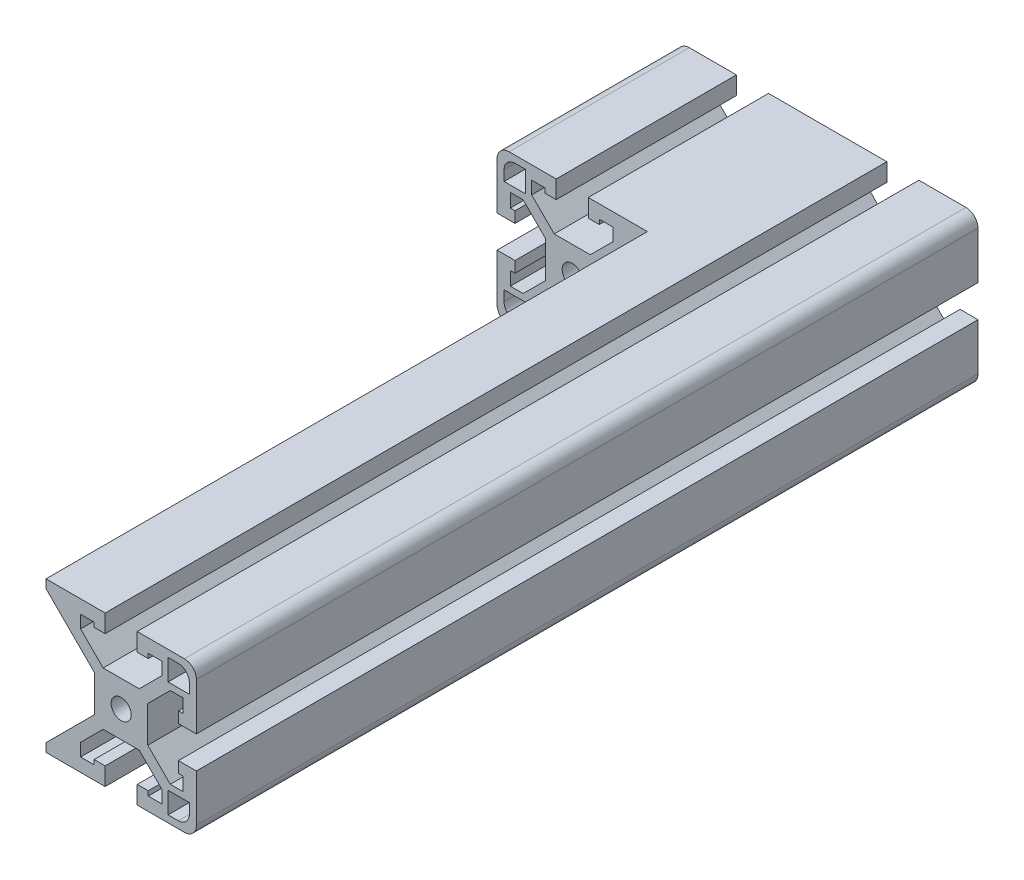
SolidWorks part; units mm, degrees
ref_plane "Front" through (0, 0, 0) normal (0, 0, 1) x (1, 0, 0)
ref_plane "Top" through (0, 0, 0) normal (0, 1, 0) x (1, 0, 0)
ref_plane "Right" through (0, 0, 0) normal (1, 0, 0) x (0, 0, -1)
sketch "Sketch1" plane through (0, 0, 0) normal (0, 0, 1) x (1, 0, 0)
  line L0 (-12.319, 4.5757) -> (-12.319, -4.5757)
  line L1 (0, 16.8947) -> (-12.319, 4.5757)
  line L2 (12.319, 4.5757) -> (0, 16.8947)
  line L3 (12.319, -4.5757) -> (12.319, 4.5757)
  line L4 (0, -16.8947) -> (12.319, -4.5757)
  line L5 (-12.319, -4.5757) -> (0, -16.8947)
  line L6 (-30.9372, 11.8872) -> (-30.9372, 17.272)
  line L7 (-36.322, 11.8872) -> (-30.9372, 11.8872)
  line L8 (-36.322, 14.478) -> (-36.322, 11.8872)
  line L9 (-30.9372, 17.272) -> (-33.528, 17.272)
  line L10 (-30.9372, -17.272) -> (-30.9372, -11.8872)
  line L11 (-33.528, -17.272) -> (-30.9372, -17.272)
  line L12 (-36.322, -11.8872) -> (-36.322, -14.478)
  line L13 (-30.9372, -11.8872) -> (-36.322, -11.8872)
  line L14 (36.322, -11.8872) -> (30.9372, -11.8872)
  line L15 (36.322, -14.478) -> (36.322, -11.8872)
  line L16 (30.9372, -17.272) -> (33.528, -17.272)
  line L17 (30.9372, -11.8872) -> (30.9372, -17.272)
  line L18 (30.9372, 17.272) -> (30.9372, 11.8872)
  line L19 (33.528, 17.272) -> (30.9372, 17.272)
  line L20 (36.322, 11.8872) -> (36.322, 14.478)
  line L21 (30.9372, 11.8872) -> (36.322, 11.8872)
  line L22 (-29.337, 12.4423) -> (-29.337, 15.6718)
  line L23 (-29.337, 15.6718) -> (-25.908, 15.6718)
  line L24 (-25.908, 15.6718) -> (-25.908, 14.5034)
  line L25 (-25.908, 14.5034) -> (-23.114, 14.5034)
  line L26 (-23.114, 14.5034) -> (-23.114, 19.05)
  line L27 (-23.114, 19.05) -> (-35.052, 19.05)
  line L28 (-38.1, 16.002) -> (-38.1, 4.064)
  line L29 (-38.1, 4.064) -> (-33.5534, 4.064)
  line L30 (-33.5534, 4.064) -> (-33.5534, 6.858)
  line L31 (-33.5534, 6.858) -> (-34.7218, 6.858)
  line L32 (-34.7218, 6.858) -> (-34.7218, 10.287)
  line L33 (-34.7218, 10.287) -> (-31.4923, 10.287)
  line L34 (-31.4923, 10.287) -> (-25.781, 4.5757)
  line L35 (-25.781, 4.5757) -> (-25.781, -4.5757)
  line L36 (-25.781, -4.5757) -> (-31.4923, -10.287)
  line L37 (-31.4923, -10.287) -> (-34.7218, -10.287)
  line L38 (-34.7218, -10.287) -> (-34.7218, -6.858)
  line L39 (-34.7218, -6.858) -> (-33.5534, -6.858)
  line L40 (-33.5534, -6.858) -> (-33.5534, -4.064)
  line L41 (-33.5534, -4.064) -> (-38.1, -4.064)
  line L42 (-38.1, -4.064) -> (-38.1, -16.002)
  line L43 (-35.052, -19.05) -> (-23.114, -19.05)
  line L44 (-23.114, -19.05) -> (-23.114, -14.5034)
  line L45 (-23.114, -14.5034) -> (-25.908, -14.5034)
  line L46 (-25.908, -14.5034) -> (-25.908, -15.6718)
  line L47 (-25.908, -15.6718) -> (-29.337, -15.6718)
  line L48 (-29.337, -15.6718) -> (-29.337, -12.4423)
  line L49 (-29.337, -12.4423) -> (-23.6257, -6.731)
  line L50 (-23.6257, -6.731) -> (-14.4743, -6.731)
  line L51 (-14.4743, -6.731) -> (-8.763, -12.4423)
  line L52 (-8.763, -12.4423) -> (-8.763, -15.6718)
  line L53 (-8.763, -15.6718) -> (-12.192, -15.6718)
  line L54 (-12.192, -15.6718) -> (-12.192, -14.5034)
  line L55 (-12.192, -14.5034) -> (-14.986, -14.5034)
  line L56 (-14.986, -14.5034) -> (-14.986, -19.05)
  line L57 (-14.986, -19.05) -> (14.986, -19.05)
  line L58 (14.986, -19.05) -> (14.986, -14.5034)
  line L59 (14.986, -14.5034) -> (12.192, -14.5034)
  line L60 (12.192, -14.5034) -> (12.192, -15.6718)
  line L61 (12.192, -15.6718) -> (8.763, -15.6718)
  line L62 (8.763, -15.6718) -> (8.763, -12.4423)
  line L63 (8.763, -12.4423) -> (14.4743, -6.731)
  line L64 (14.4743, -6.731) -> (23.6257, -6.731)
  line L65 (23.6257, -6.731) -> (29.337, -12.4423)
  line L66 (29.337, -12.4423) -> (29.337, -15.6718)
  line L67 (29.337, -15.6718) -> (25.908, -15.6718)
  line L68 (25.908, -15.6718) -> (25.908, -14.5034)
  line L69 (25.908, -14.5034) -> (23.114, -14.5034)
  line L70 (23.114, -14.5034) -> (23.114, -19.05)
  line L71 (23.114, -19.05) -> (35.052, -19.05)
  line L72 (38.1, -16.002) -> (38.1, -4.064)
  line L73 (38.1, -4.064) -> (33.5534, -4.064)
  line L74 (33.5534, -4.064) -> (33.5534, -6.858)
  line L75 (33.5534, -6.858) -> (34.7218, -6.858)
  line L76 (34.7218, -6.858) -> (34.7218, -10.287)
  line L77 (34.7218, -10.287) -> (31.4923, -10.287)
  line L78 (31.4923, -10.287) -> (25.781, -4.5757)
  line L79 (25.781, -4.5757) -> (25.781, 4.5757)
  line L80 (25.781, 4.5757) -> (31.4923, 10.287)
  line L81 (31.4923, 10.287) -> (34.7218, 10.287)
  line L82 (34.7218, 10.287) -> (34.7218, 6.858)
  line L83 (34.7218, 6.858) -> (33.5534, 6.858)
  line L84 (33.5534, 6.858) -> (33.5534, 4.064)
  line L85 (33.5534, 4.064) -> (38.1, 4.064)
  line L86 (38.1, 4.064) -> (38.1, 16.002)
  line L87 (35.052, 19.05) -> (23.114, 19.05)
  line L88 (23.114, 19.05) -> (23.114, 14.5034)
  line L89 (23.114, 14.5034) -> (25.908, 14.5034)
  line L90 (25.908, 14.5034) -> (25.908, 15.6718)
  line L91 (25.908, 15.6718) -> (29.337, 15.6718)
  line L92 (29.337, 15.6718) -> (29.337, 12.4423)
  line L93 (29.337, 12.4423) -> (23.6257, 6.731)
  line L94 (23.6257, 6.731) -> (14.4743, 6.731)
  line L95 (14.4743, 6.731) -> (8.763, 12.4423)
  line L96 (8.763, 12.4423) -> (8.763, 15.6718)
  line L97 (8.763, 15.6718) -> (12.192, 15.6718)
  line L98 (12.192, 15.6718) -> (12.192, 14.5034)
  line L99 (12.192, 14.5034) -> (14.986, 14.5034)
  line L100 (14.986, 14.5034) -> (14.986, 19.05)
  line L101 (14.986, 19.05) -> (-14.986, 19.05)
  line L102 (-14.986, 19.05) -> (-14.986, 14.5034)
  line L103 (-14.986, 14.5034) -> (-12.192, 14.5034)
  line L104 (-12.192, 14.5034) -> (-12.192, 15.6718)
  line L105 (-12.192, 15.6718) -> (-8.763, 15.6718)
  line L106 (-8.763, 15.6718) -> (-8.763, 12.4423)
  line L107 (-8.763, 12.4423) -> (-14.4743, 6.731)
  line L108 (-14.4743, 6.731) -> (-23.6257, 6.731)
  line L109 (-23.6257, 6.731) -> (-29.337, 12.4423)
  circle A0 centre (-19.05, 0) radius 2.5527
  circle A1 centre (19.05, 0) radius 2.5527
  arc A2 (-35.052, 19.05) -> (-38.1, 16.002) centre (-35.052, 16.002) ccw
  arc A3 (-38.1, -16.002) -> (-35.052, -19.05) centre (-35.052, -16.002) ccw
  arc A4 (35.052, -19.05) -> (38.1, -16.002) centre (35.052, -16.002) ccw
  arc A5 (38.1, 16.002) -> (35.052, 19.05) centre (35.052, 16.002) ccw
  arc A6 (-33.528, 17.272) -> (-36.322, 14.478) centre (-33.528, 14.478) ccw
  arc A7 (-36.322, -14.478) -> (-33.528, -17.272) centre (-33.528, -14.478) ccw
  arc A8 (33.528, -17.272) -> (36.322, -14.478) centre (33.528, -14.478) ccw
  arc A9 (36.322, 14.478) -> (33.528, 17.272) centre (33.528, 14.478) ccw
extrude "Boss-Extrude1" add sketch "Sketch1" along normal mid plane 198.0692
sketch "Sketch2" plane through (0, 0, 99.0346) normal (0, 0, 1) x (1, 0, 0)
  line L0 (14.986, 19.05) -> (-14.986, 19.05) construction
  line L1 (-38.1, 19.05) -> (0, 19.05)
  line L2 (-38.1, 19.05) -> (-38.1, -19.05)
  line L3 (-38.1, -19.05) -> (0, -19.05)
  line L4 (0, 19.05) -> (0, -19.05)
  line L5 (-23.114, 19.05) -> (-35.052, 19.05) construction
  line L6 (-38.1, 16.002) -> (-38.1, 4.064) construction
  line L7 (-14.986, -19.05) -> (14.986, -19.05) construction
  point P6 (0, 19.05)
extrude "Cut-Extrude1" cut sketch "Sketch2" against normal blind 152.4
